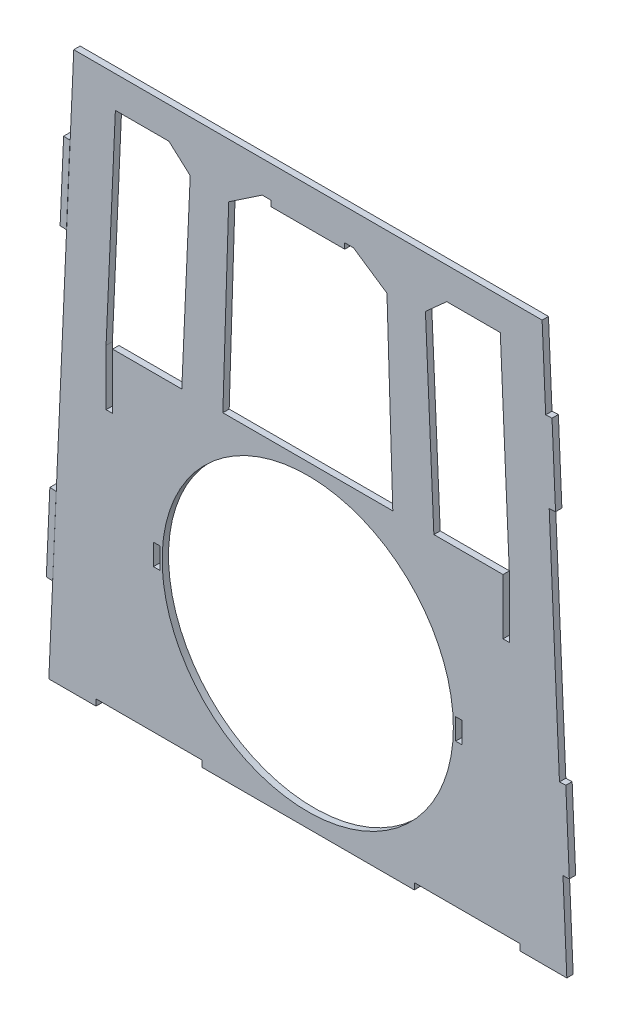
SolidWorks part; units mm, degrees
ref_plane "Front Plane" through (0, 0, 0) normal (0, 0, 1) x (1, 0, 0)
ref_plane "Top Plane" through (0, 0, 0) normal (0, 1, 0) x (1, 0, 0)
ref_plane "Right Plane" through (0, 0, 0) normal (1, 0, 0) x (0, 0, -1)
sketch "Sketch1" plane through (0, 0, 0) normal (0, 0, 1) x (1, 0, 0)
  line L0 (-62.1053, -13.2698) -> (-56.1208, 120.4303)
  line L1 (-56.1208, 120.4303) -> (56.213, 120.4303)
  line L2 (56.213, 120.4303) -> (62.1421, -13.2698)
  line L3 (62.1421, -13.2698) -> (-62.1053, -13.2698)
  line L4 (0.0184, -13.2698) -> (0.0184, -120.4303) construction
  line L5 (-48.3705, 62.8911) -> (-46.1428, 112.818)
  line L6 (-46.1428, 112.818) -> (-33.3007, 112.818)
  line L7 (-33.3007, 112.818) -> (-28.1901, 108.2316)
  line L8 (-28.1901, 108.2316) -> (-30.2131, 62.8911)
  line L9 (-30.2131, 62.8911) -> (-48.3705, 62.8911)
  line L10 (30.25, 62.8911) -> (48.4074, 62.8911)
  line L11 (28.2269, 108.2316) -> (30.25, 62.8911)
  line L12 (33.3375, 112.818) -> (28.2269, 108.2316)
  line L13 (46.1796, 112.818) -> (33.3375, 112.818)
  line L14 (48.4074, 62.8911) -> (46.1796, 112.818)
  line L15 (-20.3646, 62.8911) -> (20.4014, 62.8911)
  line L16 (20.4014, 62.8911) -> (18.9999, 107.4077)
  line L17 (18.9999, 107.4077) -> (10.9726, 112.818)
  line L18 (10.9726, 112.818) -> (8.8652, 112.818)
  line L19 (8.8652, 112.818) -> (8.8652, 111.4688)
  line L20 (8.8652, 111.4688) -> (-8.8283, 111.4688)
  line L21 (-8.8283, 112.818) -> (-8.8283, 111.4688)
  line L22 (-10.9358, 112.818) -> (-8.8283, 112.818)
  line L23 (-18.963, 107.4077) -> (-10.9358, 112.818)
  line L24 (-20.3646, 62.8911) -> (-18.963, 107.4077)
extrude "Boss-Extrude1" add sketch "Sketch1" along normal blind 1.524
sketch "Sketch2" plane through (0, 0, 1.524) normal (0, 0, 1) x (1, 0, 0)
  line L5 (0.0184, 111.4688) -> (0.0184, 198.9405) construction
  line L6 (8.8652, 111.4688) -> (-8.8283, 111.4688) construction
  line L11 (-62.7047, 7.6127) -> (-61.8607, 26.644)
  line L14 (57.9108, 82.1443) -> (59.4333, 82.2119)
  line L15 (57.0668, 101.1756) -> (58.5893, 101.2431)
  line L16 (57.9108, 82.1443) -> (57.0668, 101.1756)
  line L17 (59.4333, 82.2119) -> (58.5893, 101.2431)
  line L19 (61.219, 7.5452) -> (62.7415, 7.6127)
  line L20 (60.375, 26.5765) -> (61.8975, 26.644)
  line L21 (61.219, 7.5452) -> (60.375, 26.5765)
  line L22 (62.7415, 7.6127) -> (61.8975, 26.644)
  line L23 (-61.1822, 7.5452) -> (-60.3382, 26.5765)
  line L24 (-60.3382, 26.5765) -> (-61.8607, 26.644)
  line L25 (-61.1822, 7.5452) -> (-62.7047, 7.6127)
  line L26 (-59.3965, 82.2119) -> (-58.5525, 101.2431)
  line L27 (-57.874, 82.1443) -> (-57.03, 101.1756)
  line L28 (-57.03, 101.1756) -> (-58.5525, 101.2431)
  line L29 (-57.874, 82.1443) -> (-59.3965, 82.2119)
extrude "Boss-Extrude2" add sketch "Sketch2" against normal blind 1.524
sketch "Sketch5" plane through (0, 0, 1.524) normal (0, 0, 1) x (1, 0, 0)
  circle A0 centre (0, 25.1412) radius 34.925
  dimension "D1" = 69.85
extrude "Cut-Extrude2" cut sketch "Sketch5" against normal blind 2.54
sketch "Sketch6" plane through (0, 0, 1.524) normal (0, 0, 1) x (1, 0, 0)
  line L1 (25.5473, -11.7458) -> (50.9473, -11.7458)
  line L2 (25.5473, -11.7458) -> (25.5473, -13.2698)
  line L3 (25.5473, -13.2698) -> (50.9473, -13.2698)
  line L4 (50.9473, -11.7458) -> (50.9473, -13.2698)
  line L5 (-50.791, -11.7458) -> (-25.391, -11.7458)
  line L6 (-50.791, -11.7458) -> (-50.791, -13.2698)
  line L7 (-50.791, -13.2698) -> (-25.391, -13.2698)
  line L8 (-25.391, -11.7458) -> (-25.391, -13.2698)
extrude "Cut-Extrude3" cut sketch "Sketch6" against normal blind 1.524
sketch "Sketch7" plane through (0, 0, 1.524) normal (0, 0, 1) x (1, 0, 0)
  line L1 (-37.0095, 27.6812) -> (-35.4855, 27.6812)
  line L2 (-37.0095, 27.6812) -> (-37.0095, 22.6012)
  line L3 (-37.0095, 22.6012) -> (-35.4855, 22.6012)
  line L4 (-35.4855, 27.6812) -> (-35.4855, 22.6012)
  line L5 (37.0095, 22.6012) -> (35.4855, 22.6012)
  line L6 (37.0095, 22.6012) -> (37.0095, 27.6812)
  line L7 (37.0095, 27.6812) -> (35.4855, 27.6812)
  line L8 (35.4855, 22.6012) -> (35.4855, 27.6812)
extrude "Cut-Extrude4" cut sketch "Sketch7" against normal blind 1.524
sketch "Sketch8" plane through (0, 0, 1.524) normal (0, 0, 1) x (1, 0, 0)
  line L0 (0.0184, 111.4688) -> (0.0184, 167.0459) construction
  line L1 (48.4074, 62.8911) -> (46.8411, 62.8911)
  line L2 (48.4074, 62.8911) -> (48.4074, 49.5201)
  line L3 (48.4074, 49.5201) -> (46.8411, 49.5201)
  line L4 (46.8411, 62.8911) -> (46.8411, 49.5201)
  line L5 (8.8652, 111.4688) -> (-8.8283, 111.4688) construction
  line L6 (-46.8043, 62.8911) -> (-46.8043, 49.5201)
  line L7 (-48.3705, 49.5201) -> (-46.8043, 49.5201)
  line L8 (-48.3705, 62.8911) -> (-48.3705, 49.5201)
  line L9 (-48.3705, 62.8911) -> (-46.8043, 62.8911)
extrude "Cut-Extrude5" cut sketch "Sketch8" against normal blind 1.524
ref_plane "Plane1" through (-18.963, 107.4077, 0) normal (0.0315, 0.9995, 0) x (0.9995, -0.0315, 0)
